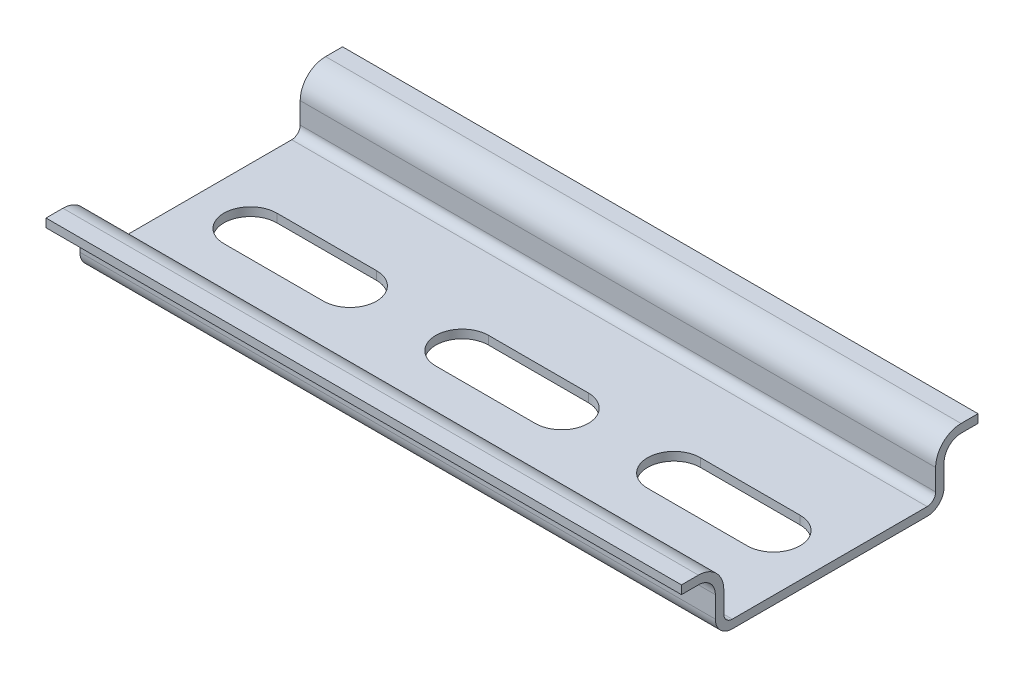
SolidWorks part; units mm, degrees
ref_plane "Front Plane" through (0, 0, 0) normal (0, 0, 1) x (1, 0, 0)
ref_plane "Top Plane" through (0, 0, 0) normal (0, 1, 0) x (1, 0, 0)
ref_plane "Right Plane" through (0, 0, 0) normal (1, 0, 0) x (0, 0, -1)
sketch "Sketch1" plane through (0, 0, 0) normal (1, 0, 0) x (0, 0, -1)
  line L0 (0, 0) -> (0, 18.2344) construction
  line L1 (0, 0) -> (26.621, 0) construction
  line L2 (-11.5, 0) -> (11.5, 0)
  line L3 (13.5, 2) -> (13.5, 4.5)
  line L4 (15.5, 6.5) -> (17.5, 6.5)
  line L5 (-13.5, 2) -> (-13.5, 4.5)
  line L6 (-15.5, 6.5) -> (-17.5, 6.5)
  arc A0 (13.5, 2) -> (11.5, 0) centre (11.5, 2) cw
  arc A1 (15.5, 6.5) -> (13.5, 4.5) centre (15.5, 4.5) ccw
  arc A2 (-13.5, 2) -> (-11.5, 0) centre (-11.5, 2) ccw
  arc A3 (-15.5, 6.5) -> (-13.5, 4.5) centre (-15.5, 4.5) cw
  point P9 (13.5, 0)
  dimension "D1" = 2
  dimension "D3" = 2
  dimension "D2" = 6.5
  dimension "D4" = 35
  dimension "D5" = 27
extrude "Extrude-Thin1" add sketch "Sketch1" along normal blind 37.5 and the other way blind 37.5 thin
sketch "Sketch2" plane through (0, 0, 0) normal (0, -1, 0) x (1, 0, 0)
  line L0 (0, 6.6969) -> (0, 0) construction
  line L1 (0, 0) -> (9.9599, 0) construction
  line L2 (-5.875, 3.125) -> (5.875, 3.125)
  line L3 (-5.875, -3.125) -> (5.875, -3.125)
  arc A0 (5.875, 3.125) -> (5.875, -3.125) centre (5.875, 0) cw
  arc A1 (-5.875, 3.125) -> (-5.875, -3.125) centre (-5.875, 0) ccw
  point P6 (0, 3.125)
  point P12 (0, -3.125)
  dimension "D2" = 11.75
  dimension "D1" = 6.25
extrude "Cut-Extrude1" cut sketch "Sketch2" against normal up to next
pattern_linear "LPattern1" count 2 spacing 25 along (1, 0, 0) count 2 spacing 25 along (-1, 0, 0) of "Cut-Extrude1"
